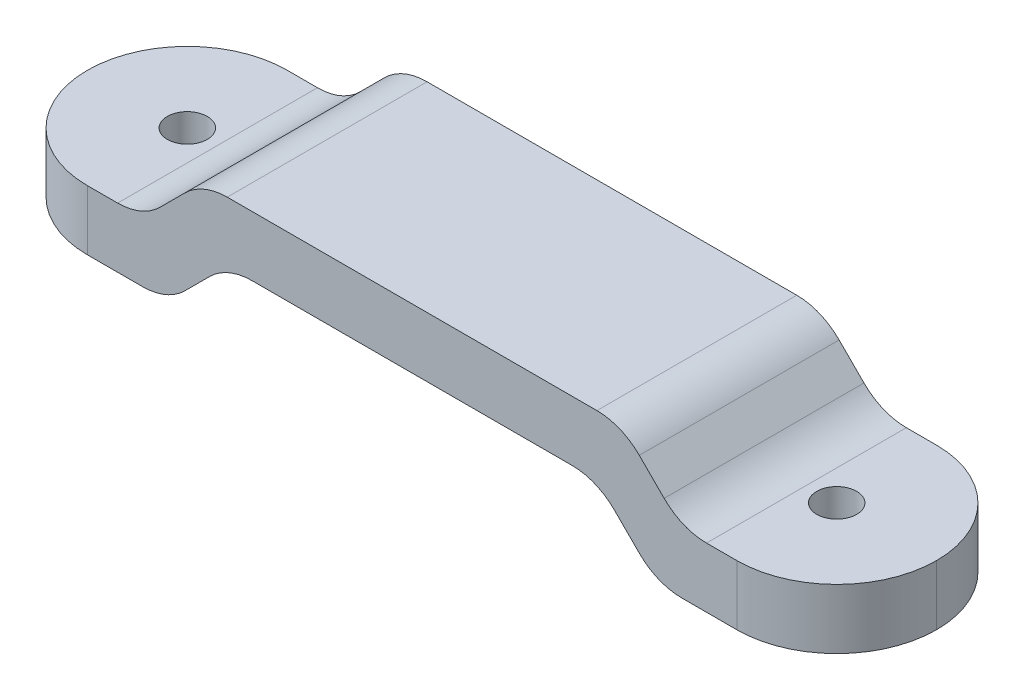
SolidWorks part; units mm, degrees
ref_plane "Frontal" through (0, 0, 0) normal (0, 0, 1) x (1, 0, 0)
ref_plane "Horizontal" through (0, 0, 0) normal (0, 1, 0) x (1, 0, 0)
ref_plane "Vertical" through (0, 0, 0) normal (1, 0, 0) x (0, 0, -1)
sketch "Esquisse1" plane through (0, 0, 0) normal (0, 0, 1) x (1, 0, 0)
  line L0 (-21.25, 0) -> (-12.25, 0)
  line L1 (-12.25, 0) -> (-9.25, 3)
  line L2 (-9.25, 3) -> (9.25, 3)
  line L3 (21.25, 0) -> (12.25, 0)
  line L4 (12.25, 0) -> (9.25, 3)
  line L5 (0, 3) -> (0, -11.4979) construction
  dimension "D1" = 42.5
  dimension "D2" = 9
  dimension "D3" = 3
  dimension "D4" = 45
extrude "Base-Extru.-Mince" add sketch "Esquisse1" along normal blind 10 thin
fillet "Congé3" radius 3
sketch "Esquisse2" plane through (0, 3, 0) normal (0, 1, 0) x (-1, 0, 0)
  line L0 (21.25, 5) -> (-44.2758, 5) construction
  line L1 (21.25, 10) -> (21.25, 0) construction
  line L2 (0, 10) -> (0, -8.4796) construction
  line L3 (-9.25, 10) -> (9.25, 10) construction
  circle A0 centre (16.25, 5) radius 1
  circle A1 centre (-16.25, 5) radius 1
  dimension "D1" = 32.5
  dimension "D2" = 2
extrude "Enlèv. mat.-Extru.1" cut sketch "Esquisse2" against normal through all
fillet "Congé4" radius 5
